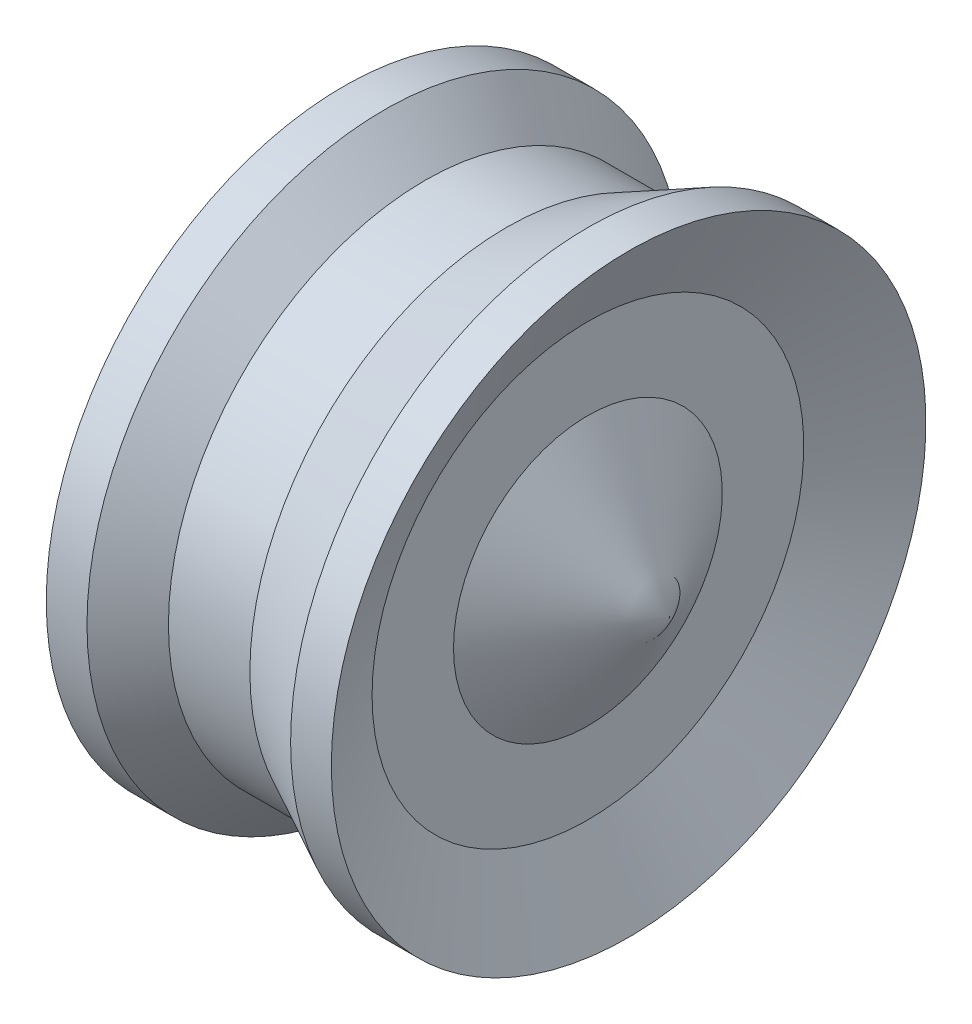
SolidWorks part; units mm, degrees
ref_plane "Plan1" through (0, 0, 0) normal (0, 0, 1) x (1, 0, 0)
ref_plane "Plan2" through (0, 0, 0) normal (0, 1, 0) x (1, 0, 0)
ref_plane "Plan3" through (0, 0, 0) normal (1, 0, 0) x (0, 0, -1)
sketch "Esquisse1" plane through (0, 0, 0) normal (0, 0, 1) x (1, 0, 0)
  line L0 (0, 0) -> (0, -2)
  line L1 (0, -2) -> (-0.5, -2)
  line L2 (-0.5, -2) -> (-0.5, -1.5)
  line L3 (-0.5, -1.5) -> (-2, -1.5)
  line L4 (-2, -1.5) -> (-2, -3.65)
  line L5 (-2, -3.65) -> (-1.5, -3.65)
  line L6 (-1.5, -3.65) -> (-1, -3.15)
  line L7 (-1, -3.15) -> (0, -3.15)
  line L8 (0, -3.15) -> (1, -3.65)
  line L9 (1, -3.65) -> (1.5, -3.65)
  line L10 (1.5, -3.65) -> (1, -2.65)
  line L11 (1, -2.65) -> (1, -1.65)
  line L12 (2, 0) -> (0, 0)
  line L13 (2, 0) -> (1, -1.65)
  line L14 (0, 0) -> (9, 0) construction
  dimension "D1" = 2
  dimension "D2" = 0.5
  dimension "D3" = 1.5
  dimension "D4" = 2.15
  dimension "D5" = 0.5
  dimension "D6" = 0.5
  dimension "D7" = 1
  dimension "D8" = 0.5
  dimension "D9" = 0.5
  dimension "D10" = 1
  dimension "D11" = 0.5
  dimension "D12" = 0.5
  dimension "D13" = 1
  dimension "D14" = 0.5
  dimension "D15" = 1
  dimension "D16" = 1
revolve "Base-Révolution" add sketch "Esquisse1" angle 360 about L14
